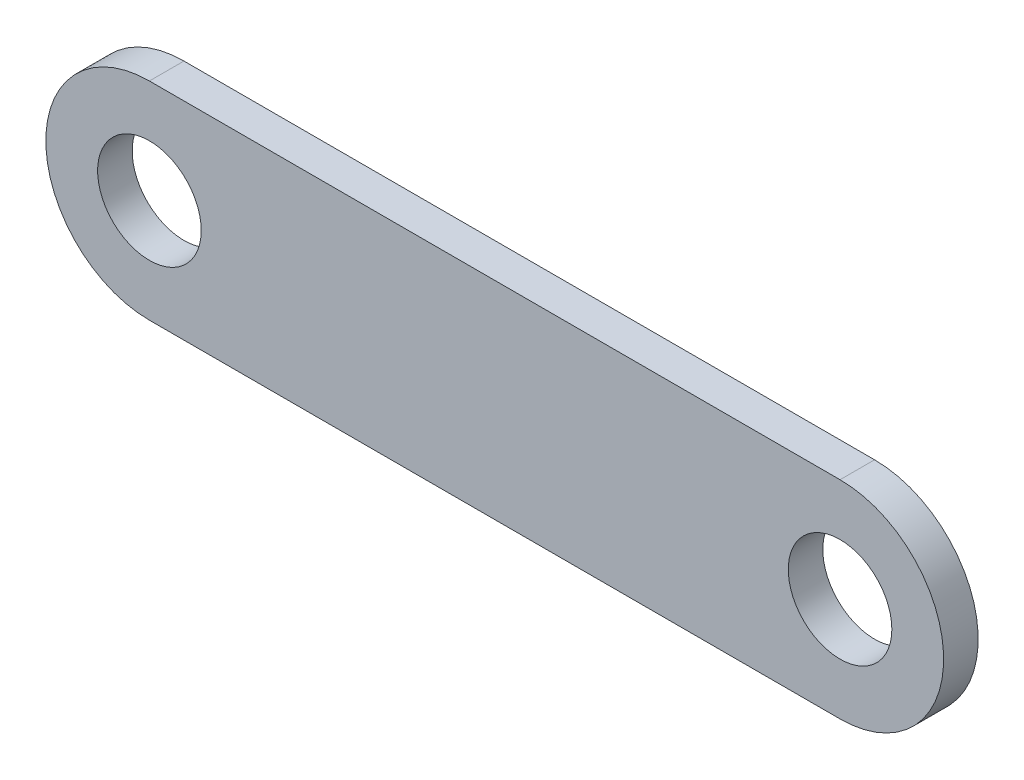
SolidWorks part; units mm, degrees
ref_plane "Front Plane" through (0, 0, 0) normal (0, 0, 1) x (1, 0, 0)
ref_plane "Top Plane" through (0, 0, 0) normal (0, 1, 0) x (1, 0, 0)
ref_plane "Right Plane" through (0, 0, 0) normal (1, 0, 0) x (0, 0, -1)
sketch "Sketch1" plane through (0, 0, 0) normal (0, 0, 1) x (1, 0, 0)
  line L0 (0, 0) -> (0, 38.8357) construction
  line L1 (-31.75, 9.525) -> (31.75, 9.525)
  line L2 (-31.75, -9.525) -> (31.75, -9.525)
  circle A0 centre (31.75, 0) radius 4.7625
  circle A1 centre (-31.75, 0) radius 4.7625
  arc A2 (-31.75, 9.525) -> (-31.75, -9.525) centre (-31.75, 0) ccw
  arc A3 (31.75, -9.525) -> (31.75, 9.525) centre (31.75, 0) ccw
  dimension "D2" = 9.525
  dimension "D3" = 9.525
  dimension "D4" = 19.05
  dimension "D1" = 63.5
extrude "Extrude1" add sketch "Sketch1" along normal blind 3.175
